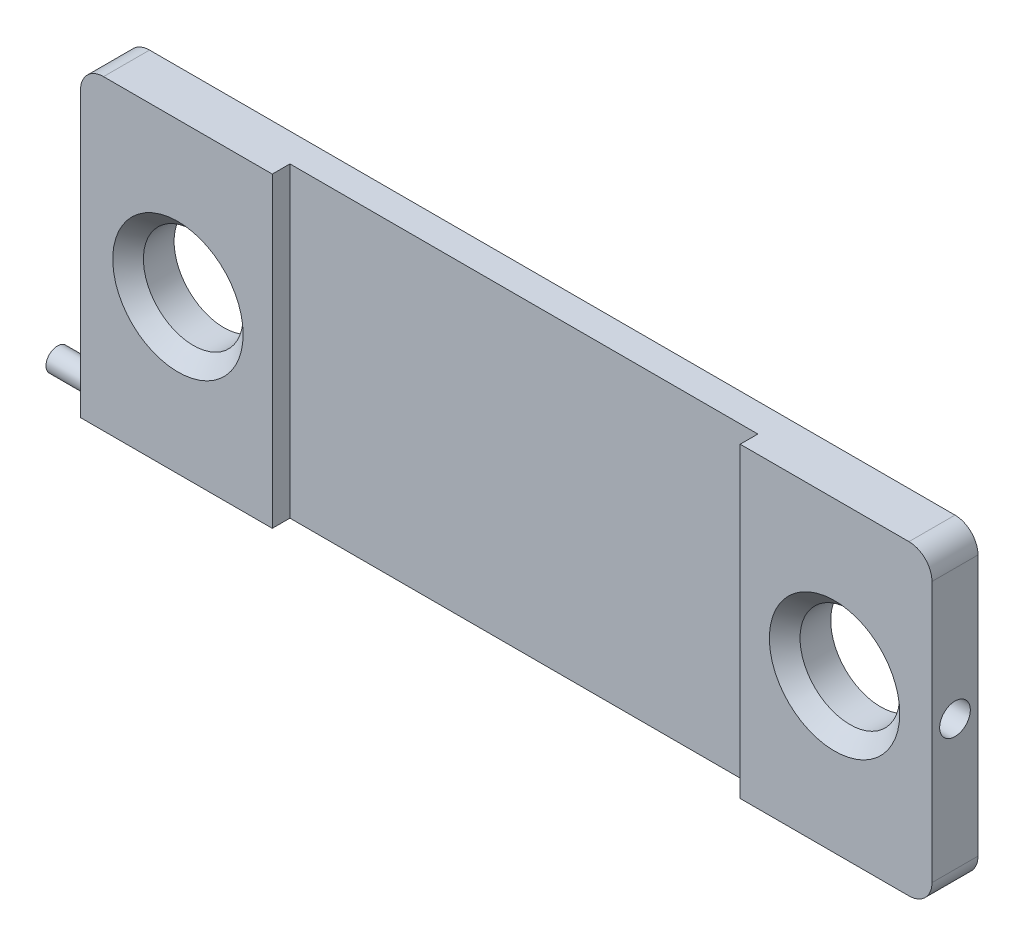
SolidWorks part; units mm, degrees
ref_plane "Plan de face" through (0, 0, 0) normal (0, 0, 1) x (1, 0, 0)
ref_plane "Plan de dessus" through (0, 0, 0) normal (0, 1, 0) x (1, 0, 0)
ref_plane "Plan de droite" through (0, 0, 0) normal (1, 0, 0) x (0, 0, -1)
sketch "Esquisse1" plane through (0, 0, 0) normal (0, 0, 1) x (1, 0, 0)
  line L0 (0, 0) -> (-42.8, 0)
  line L1 (-55.5, 20) -> (55.5, 20)
  line L2 (-55.5, 20) -> (-55.5, -20)
  line L3 (-55.5, -20) -> (55.5, -20)
  line L4 (55.5, 20) -> (55.5, -20)
  line L5 (0, 0) -> (42.8, 0)
  circle A0 centre (-42.8, 0) radius 6.5
  circle A1 centre (42.8, 0) radius 6.5
  dimension "D5" = 13
  dimension "D1" = 111
  dimension "D2" = 40
  dimension "D3" = 20
  dimension "D4" = 55.5
  dimension "D6" = 85.6
extrude "Extrusion1" add sketch "Esquisse1" along normal mid plane 6
fillet "Congé1" radius 3 3 edges at (55.5, -20, 0) (55.5, 20, 0) (-55.5, 20, 0)
chamfer "Chanfrein1" distance 2 angle 45 2 edges at (49.3, 0, 3) (-36.3, 0, 3)
sketch "Esquisse2" plane through (0, 0, 3) normal (0, 0, 1) x (1, 0, 0)
  line L0 (-52.5, 20) -> (52.5, 20) construction
  line L1 (-30.5, 20) -> (30.5, 20)
  line L2 (-30.5, 20) -> (-30.5, -20)
  line L3 (-30.5, -20) -> (30.5, -20)
  line L4 (30.5, 20) -> (30.5, -20)
  line L5 (-55.5, -20) -> (52.5, -20) construction
  dimension "D1" = 61
  dimension "D2" = 30.5
extrude "Enlèv. mat.-Extru.1" cut sketch "Esquisse2" against normal blind 2.3
hole_wizard "Dégagement M1.61" positions "Esquisse3D1" profile "Esquisse3" hole size "M1.6" standard "Ansi Métrique"
sketch3d "Esquisse3D1"
  line L2 (-55.5, 17, -3) -> (-55.5, -20, -3) construction
  line L3 (-55.5, -20, 3) -> (-55.5, -20, -3) construction
  point P0 (-55.5, 0, 0)
  dimension "D1" = 3
  dimension "D2" = 20
sketch "Esquisse3" plane through (-55.5, 0, 0) normal (0, 1, 0) x (0, 0, 1)
  line L0 (0, 0) -> (0, 5.7)
  line L1 (0, 5.7) -> (2, 3.7)
  line L2 (2, 3.7) -> (2, 0)
  line L5 (2, 0) -> (0, 0)
  line L10 (0, 5.7) -> (-2, 3.7) construction
  line L11 (0, -6.35) -> (0, 107.95) construction
  dimension "Diamètre du perçage" = 4
  dimension "Profondeur du perçage" = 3.7
  dimension "Angle de pointe" = 90
mirror "Symétrie1" about plane through (0, 0, 0) normal (1, 0, 0) of "Dégagement M1.61"
hole_wizard "Trou taraudé M3x0.51" positions "Esquisse3D2" profile "Esquisse4" tap size "M3x0.5" standard "ISO"
sketch3d "Esquisse3D2"
  line L0 (-55.5, -20, 3) -> (-55.5, -20, -3) construction
  line L1 (-55.5, 17, -3) -> (-55.5, -20, -3) construction
  point P0 (-55.5, -17.9, 0)
  dimension "D1" = 2.1
  dimension "D2" = 3
sketch "Esquisse4" plane through (-55.5, -17.9, 0) normal (0, 1, 0) x (0, 0, 1)
  line L0 (0, 0) -> (0, 8.2511)
  line L1 (0, 8.2511) -> (1.25, 7.5)
  line L2 (1.25, 7.5) -> (1.25, 0)
  line L5 (1.25, 0) -> (0, 0)
  line L10 (0, 8.2511) -> (-1.25, 7.5) construction
  line L11 (0, -6.35) -> (0, 107.95) construction
  dimension "Diamètre du trou pour taraudage" = 2.5
  dimension "Profondeur du trou pour taraudage" = 7.5
  dimension "Angle de pointe" = 118
sketch "Esquisse5" plane through (-55.5, 0, 0) normal (-1, 0, 0) x (0, 0, 1)
  circle A0 centre (0, -17.9) radius 1.5
  dimension "D1" = 3
extrude "Boss.-Extru.1" add sketch "Esquisse5" along normal mid plane 12
